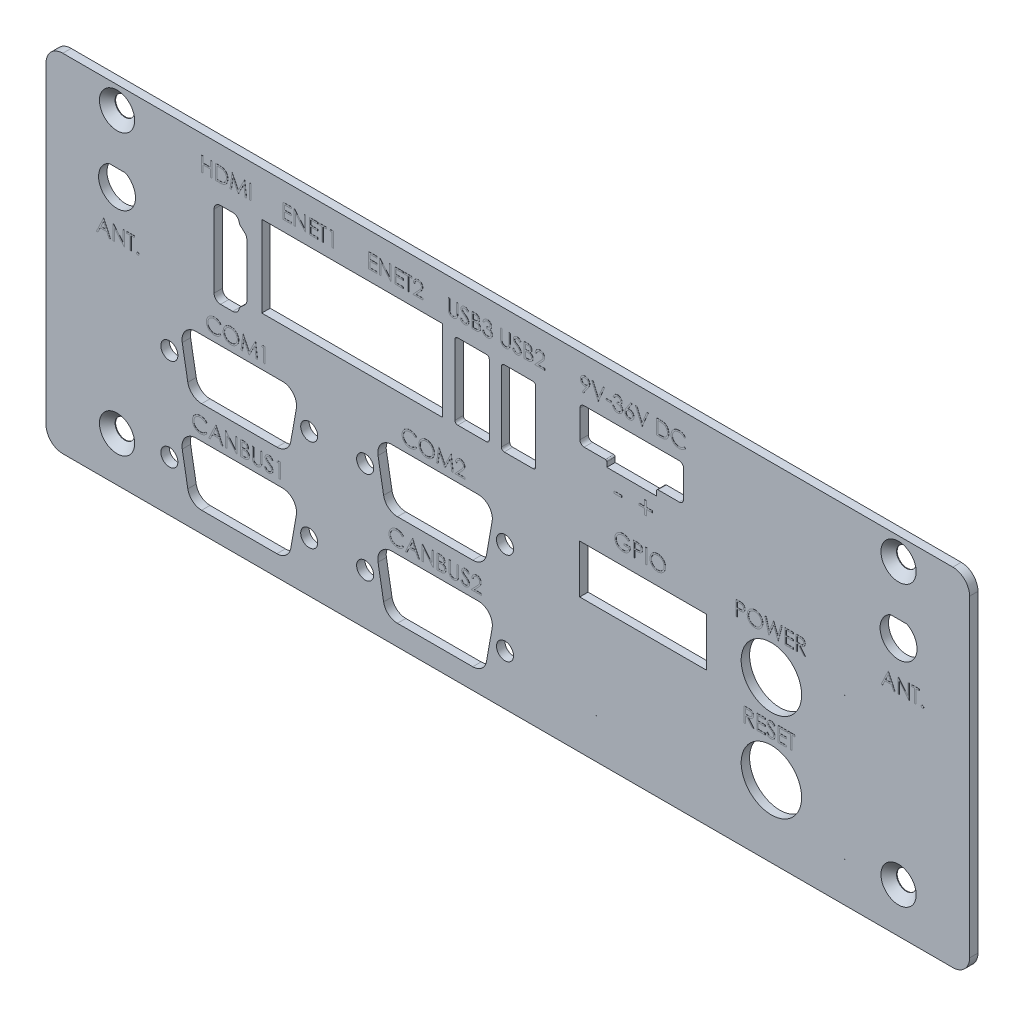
SolidWorks part; units mm, degrees
ref_plane "Front Plane" through (0, 0, 0) normal (0, 0, 1) x (1, 0, 0)
ref_plane "Top Plane" through (0, 0, 0) normal (0, 1, 0) x (1, 0, 0)
ref_plane "Right Plane" through (0, 0, 0) normal (1, 0, 0) x (0, 0, -1)
sketch "Sketch1" plane through (0, 0, 0) normal (1, 0, 0) x (0, 0, -1)
  line L0 (0, 34.1) -> (0, -34.1) construction
  line L1 (0, 0) -> (0, 62)
  line L3 (0.839, 0) -> (-0.839, 0) construction
  point P6 (0, 0)
  dimension "D2" = 62
extrude "Extrude-Thin1" add sketch "Sketch1" against normal blind 165.1 thin
sketch "Sketch4" plane through (0, 0, 1.5) normal (0, 0, 1) x (1, 0, 0)
  line L1 (-152.4, 58) -> (-12.7, 58) construction
  line L2 (-152.4, 58) -> (-152.4, 8) construction
  line L3 (-152.4, 8) -> (-12.7, 8) construction
  line L4 (-12.7, 58) -> (-12.7, 8) construction
  line L6 (-82.55, 8) -> (-82.55, 0) construction
  line L7 (0.839, 0) -> (-0.839, 0) construction
  line L8 (-165.1, 0) -> (0, 0) construction
  circle A0 centre (-152.4, 58) radius 1.75
  circle A1 centre (-152.4, 8) radius 1.75
  circle A2 centre (-12.7, 58) radius 1.75
  circle A3 centre (-12.7, 8) radius 1.75
  circle A6 centre (-152.4, 58) radius 1.75 construction
  point P19 (-82.55, 0)
  dimension "D1" = 3.5
  dimension "D5" = 8
extrude "Cut-Extrude3" cut sketch "Sketch4" against normal through all
sketch "Sketch10" plane through (0, 0, 1.5) normal (0, 0, 1) x (1, 0, 0)
  line L2 (-83.7033, 53.2428) -> (-77.5673, 53.2428) construction
  line L8 (-77.5673, 39.7268) -> (-77.5673, 53.2428) construction
  line L11 (-69.6623, 53.2748) -> (-69.6623, 48.3748) construction
  line L13 (-68.9083, 47.6208) -> (-65.1083, 47.6208) construction
  line L14 (-64.8623, 47.3748) -> (-64.8623, 46.5208) construction
  line L15 (-64.8623, 46.5208) -> (-55.9443, 46.5208) construction
  line L16 (-55.9443, 46.5208) -> (-55.9443, 47.3748) construction
  line L17 (-83.7033, 39.7268) -> (-77.5673, 39.7268) construction
  line L20 (-83.7033, 53.2428) -> (-83.7033, 39.7268) construction
  line L23 (-55.6983, 47.6208) -> (-51.8983, 47.6208) construction
  line L24 (-51.1443, 48.3748) -> (-51.1443, 53.2748) construction
  line L25 (-51.8983, 54.0288) -> (-68.9083, 54.0288) construction
  line L26 (-69.6623, 53.2748) -> (-69.6623, 48.3748)
  line L27 (-68.9083, 47.6208) -> (-65.1083, 47.6208)
  line L28 (-64.8623, 47.3748) -> (-64.8623, 46.5208)
  line L29 (-64.8623, 46.5208) -> (-55.9443, 46.5208)
  line L30 (-55.9443, 46.5208) -> (-55.9443, 47.3748)
  line L31 (-55.6983, 47.6208) -> (-51.8983, 47.6208)
  line L32 (-51.1443, 48.3748) -> (-51.1443, 53.2748)
  line L33 (-51.8983, 54.0288) -> (-68.9083, 54.0288)
  line L34 (-131.7185, 52.5388) -> (-133.9021, 52.5388) construction
  line L35 (-135.0561, 51.3848) -> (-135.0561, 38.3848) construction
  line L36 (-133.9021, 37.2308) -> (-131.7185, 37.2308) construction
  line L37 (-130.6181, 38.0373) -> (-130.509, 38.3826) construction
  line L38 (-130.4129, 38.5335) -> (-129.5723, 39.304) construction
  line L39 (-129.1981, 40.1547) -> (-129.1981, 49.6148) construction
  line L40 (-129.5723, 50.4655) -> (-130.4129, 51.236) construction
  line L41 (-130.509, 51.3869) -> (-130.6181, 51.7323) construction
  line L42 (-131.7185, 52.5388) -> (-133.9021, 52.5388)
  line L43 (-135.0561, 51.3848) -> (-135.0561, 38.3848)
  line L44 (-133.9021, 37.2308) -> (-131.7185, 37.2308)
  line L45 (-130.6181, 38.0373) -> (-130.509, 38.3826)
  line L46 (-130.4129, 38.5335) -> (-129.5723, 39.304)
  line L47 (-129.1981, 40.1547) -> (-129.1981, 49.6148)
  line L48 (-129.5723, 50.4655) -> (-130.4129, 51.236)
  line L49 (-130.509, 51.3869) -> (-130.6181, 51.7323)
  line L50 (-85.8618, 53.2428) -> (-91.9978, 53.2428) construction
  line L51 (-91.9978, 53.2428) -> (-91.9978, 39.7268) construction
  line L52 (-91.9978, 39.7268) -> (-85.8618, 39.7268) construction
  line L53 (-85.8618, 39.7268) -> (-85.8618, 53.2428) construction
  line L54 (-126.5236, 54.0828) -> (-94.2676, 54.0828) construction
  line L55 (-94.2676, 54.0828) -> (-94.2676, 39.5668) construction
  line L56 (-94.2676, 39.5668) -> (-126.5236, 39.5668) construction
  line L57 (-126.5236, 39.5668) -> (-126.5236, 54.0828) construction
  line L58 (-83.7033, 53.2428) -> (-77.5673, 53.2428)
  line L59 (-77.5673, 39.7268) -> (-77.5673, 53.2428)
  line L60 (-83.7033, 39.7268) -> (-77.5673, 39.7268)
  line L61 (-83.7033, 53.2428) -> (-83.7033, 39.7268)
  line L62 (-85.8618, 53.2428) -> (-91.9978, 53.2428)
  line L63 (-91.9978, 53.2428) -> (-91.9978, 39.7268)
  line L64 (-91.9978, 39.7268) -> (-85.8618, 39.7268)
  line L65 (-85.8618, 39.7268) -> (-85.8618, 53.2428)
  line L66 (-126.5236, 54.0828) -> (-94.2676, 54.0828)
  line L67 (-94.2676, 54.0828) -> (-94.2676, 39.5668)
  line L68 (-94.2676, 39.5668) -> (-126.5236, 39.5668)
  line L69 (-126.5236, 39.5668) -> (-126.5236, 54.0828)
  arc A0 (-133.9021, 52.5388) -> (-135.0561, 51.3848) centre (-133.9021, 51.3848) ccw construction
  arc A1 (-135.0561, 38.3848) -> (-133.9021, 37.2308) centre (-133.9021, 38.3848) ccw construction
  arc A2 (-131.7185, 37.2308) -> (-130.6181, 38.0373) centre (-131.7185, 38.3848) ccw construction
  arc A3 (-130.4129, 38.5335) -> (-130.509, 38.3826) centre (-130.1791, 38.2784) ccw construction
  arc A4 (-129.5723, 39.304) -> (-129.1981, 40.1547) centre (-130.3521, 40.1547) ccw construction
  arc A5 (-129.1981, 49.6148) -> (-129.5723, 50.4655) centre (-130.3521, 49.6148) ccw construction
  arc A6 (-130.509, 51.3869) -> (-130.4129, 51.236) centre (-130.1791, 51.4911) ccw construction
  arc A7 (-130.6181, 51.7323) -> (-131.7185, 52.5388) centre (-131.7185, 51.3848) ccw construction
  arc A16 (-68.9083, 54.0288) -> (-69.6623, 53.2748) centre (-68.9083, 53.2748) ccw construction
  arc A17 (-69.6623, 48.3748) -> (-68.9083, 47.6208) centre (-68.9083, 48.3748) ccw construction
  arc A18 (-64.8623, 47.3748) -> (-65.1083, 47.6208) centre (-65.1083, 47.3748) ccw construction
  arc A19 (-55.6983, 47.6208) -> (-55.9443, 47.3748) centre (-55.6983, 47.3748) ccw construction
  arc A20 (-51.8983, 47.6208) -> (-51.1443, 48.3748) centre (-51.8983, 48.3748) ccw construction
  arc A21 (-51.1443, 53.2748) -> (-51.8983, 54.0288) centre (-51.8983, 53.2748) ccw construction
  arc A28 (-68.9083, 54.0288) -> (-69.6623, 53.2748) centre (-68.9083, 53.2748) ccw
  arc A29 (-69.6623, 48.3748) -> (-68.9083, 47.6208) centre (-68.9083, 48.3748) ccw
  arc A30 (-64.8623, 47.3748) -> (-65.1083, 47.6208) centre (-65.1083, 47.3748) ccw
  arc A31 (-55.6983, 47.6208) -> (-55.9443, 47.3748) centre (-55.6983, 47.3748) ccw
  arc A32 (-51.8983, 47.6208) -> (-51.1443, 48.3748) centre (-51.8983, 48.3748) ccw
  arc A33 (-51.1443, 53.2748) -> (-51.8983, 54.0288) centre (-51.8983, 53.2748) ccw
  arc A34 (-133.9021, 52.5388) -> (-135.0561, 51.3848) centre (-133.9021, 51.3848) ccw
  arc A35 (-135.0561, 38.3848) -> (-133.9021, 37.2308) centre (-133.9021, 38.3848) ccw
  arc A36 (-131.7185, 37.2308) -> (-130.6181, 38.0373) centre (-131.7185, 38.3848) ccw
  arc A37 (-130.4129, 38.5335) -> (-130.509, 38.3826) centre (-130.1791, 38.2784) ccw
  arc A38 (-129.5723, 39.304) -> (-129.1981, 40.1547) centre (-130.3521, 40.1547) ccw
  arc A39 (-129.1981, 49.6148) -> (-129.5723, 50.4655) centre (-130.3521, 49.6148) ccw
  arc A40 (-130.509, 51.3869) -> (-130.4129, 51.236) centre (-130.1791, 51.4911) ccw
  arc A41 (-130.6181, 51.7323) -> (-131.7185, 52.5388) centre (-131.7185, 51.3848) ccw
extrude "444 IO CUTOUTS" cut sketch "Sketch10" against normal up to surface (1.5 mm away)
sketch "Sketch3" plane through (0, 0, 1.5) normal (0, 0, 1) x (1, 0, 0)
  circle A2 centre (-12.7, 46.125) radius 3.3
  circle A3 centre (-12.7, 46.125) radius 3.3
  circle A8 centre (-152.4, 46.125) radius 3.3
  circle A9 centre (-152.4, 46.125) radius 3.3
  dimension "D2" = 0
  dimension "D1" = 0
extrude "SMA BULKHEAD CUTOUTS" cut sketch "Sketch3" against normal through all
sketch "Sketch11" plane through (0, 0, 1.5) normal (0, 0, 1) x (1, 0, 0)
  line L0 (-105.7469, 27.8881) -> (-104.7506, 22.2381) construction
  line L1 (-88.8212, 20.164) -> (-102.2788, 20.164) construction
  line L2 (-85.3531, 27.8881) -> (-86.3494, 22.2381) construction
  line L3 (-87.825, 30.834) -> (-103.275, 30.834) construction
  line L4 (-140.7469, 27.8881) -> (-139.7506, 22.2381) construction
  line L5 (-137.2788, 20.164) -> (-123.8212, 20.164) construction
  line L6 (-120.3531, 27.8881) -> (-121.3494, 22.2381) construction
  line L7 (-138.275, 30.834) -> (-122.825, 30.834) construction
  line L8 (-105.7469, 27.8881) -> (-104.7506, 22.2381)
  line L9 (-88.8212, 20.164) -> (-102.2788, 20.164)
  line L10 (-85.3531, 27.8881) -> (-86.3494, 22.2381)
  line L11 (-87.825, 30.834) -> (-103.275, 30.834)
  line L12 (-140.7469, 27.8881) -> (-139.7506, 22.2381)
  line L13 (-137.2788, 20.164) -> (-123.8212, 20.164)
  line L14 (-120.3531, 27.8881) -> (-121.3494, 22.2381)
  line L15 (-138.275, 30.834) -> (-122.825, 30.834)
  circle A0 centre (-83.05, 25.5) radius 1.524 construction
  arc A1 (-103.275, 30.834) -> (-105.7469, 27.8881) centre (-103.275, 28.324) ccw construction
  arc A2 (-104.7506, 22.2381) -> (-102.2788, 20.164) centre (-102.2788, 22.674) ccw construction
  arc A3 (-88.8212, 20.164) -> (-86.3494, 22.2381) centre (-88.8212, 22.674) ccw construction
  arc A4 (-85.3531, 27.8881) -> (-87.825, 30.834) centre (-87.825, 28.324) ccw construction
  circle A5 centre (-108.05, 25.5) radius 1.524 construction
  circle A6 centre (-118.05, 25.5) radius 1.524 construction
  arc A7 (-139.7506, 22.2381) -> (-137.2788, 20.164) centre (-137.2788, 22.674) ccw construction
  arc A8 (-123.8212, 20.164) -> (-121.3494, 22.2381) centre (-123.8212, 22.674) ccw construction
  arc A9 (-120.3531, 27.8881) -> (-122.825, 30.834) centre (-122.825, 28.324) ccw construction
  arc A10 (-138.275, 30.834) -> (-140.7469, 27.8881) centre (-138.275, 28.324) ccw construction
  circle A11 centre (-143.05, 25.5) radius 1.524 construction
  circle A12 centre (-83.05, 25.5) radius 1.524
  arc A13 (-103.275, 30.834) -> (-105.7469, 27.8881) centre (-103.275, 28.324) ccw
  arc A14 (-104.7506, 22.2381) -> (-102.2788, 20.164) centre (-102.2788, 22.674) ccw
  arc A15 (-88.8212, 20.164) -> (-86.3494, 22.2381) centre (-88.8212, 22.674) ccw
  arc A16 (-85.3531, 27.8881) -> (-87.825, 30.834) centre (-87.825, 28.324) ccw
  circle A17 centre (-108.05, 25.5) radius 1.524
  circle A18 centre (-118.05, 25.5) radius 1.524
  arc A19 (-139.7506, 22.2381) -> (-137.2788, 20.164) centre (-137.2788, 22.674) ccw
  arc A20 (-123.8212, 20.164) -> (-121.3494, 22.2381) centre (-123.8212, 22.674) ccw
  arc A21 (-120.3531, 27.8881) -> (-122.825, 30.834) centre (-122.825, 28.324) ccw
  arc A22 (-138.275, 30.834) -> (-140.7469, 27.8881) centre (-138.275, 28.324) ccw
  circle A23 centre (-143.05, 25.5) radius 1.524
extrude "COM CUTOUTS" cut sketch "Sketch11" against normal up to surface (1.5 mm away)
sketch "Sketch12" plane through (0, 0, 1.5) normal (0, 0, 1) x (1, 0, 0)
  line L0 (-105.7469, 11.3881) -> (-104.7506, 5.7381) construction
  line L1 (-88.8212, 3.664) -> (-102.2788, 3.664) construction
  line L2 (-85.3531, 11.3881) -> (-86.3494, 5.7381) construction
  line L3 (-87.825, 14.334) -> (-103.275, 14.334) construction
  line L4 (-140.7469, 11.3881) -> (-139.7506, 5.7381) construction
  line L5 (-137.2788, 3.664) -> (-123.8212, 3.664) construction
  line L6 (-120.3531, 11.3881) -> (-121.3494, 5.7381) construction
  line L7 (-138.275, 14.334) -> (-122.825, 14.334) construction
  line L8 (-105.7469, 11.3881) -> (-104.7506, 5.7381)
  line L9 (-88.8212, 3.664) -> (-102.2788, 3.664)
  line L10 (-85.3531, 11.3881) -> (-86.3494, 5.7381)
  line L11 (-87.825, 14.334) -> (-103.275, 14.334)
  line L12 (-140.7469, 11.3881) -> (-139.7506, 5.7381)
  line L13 (-137.2788, 3.664) -> (-123.8212, 3.664)
  line L14 (-120.3531, 11.3881) -> (-121.3494, 5.7381)
  line L15 (-138.275, 14.334) -> (-122.825, 14.334)
  circle A0 centre (-83.05, 9) radius 1.524 construction
  arc A1 (-103.275, 14.334) -> (-105.7469, 11.3881) centre (-103.275, 11.824) ccw construction
  arc A2 (-104.7506, 5.7381) -> (-102.2788, 3.664) centre (-102.2788, 6.174) ccw construction
  arc A3 (-88.8212, 3.664) -> (-86.3494, 5.7381) centre (-88.8212, 6.174) ccw construction
  arc A4 (-85.3531, 11.3881) -> (-87.825, 14.334) centre (-87.825, 11.824) ccw construction
  circle A5 centre (-108.05, 9) radius 1.524 construction
  circle A6 centre (-118.05, 9) radius 1.524 construction
  arc A7 (-138.275, 14.334) -> (-140.7469, 11.3881) centre (-138.275, 11.824) ccw construction
  arc A8 (-139.7506, 5.7381) -> (-137.2788, 3.664) centre (-137.2788, 6.174) ccw construction
  arc A9 (-123.8212, 3.664) -> (-121.3494, 5.7381) centre (-123.8212, 6.174) ccw construction
  arc A10 (-120.3531, 11.3881) -> (-122.825, 14.334) centre (-122.825, 11.824) ccw construction
  circle A11 centre (-143.05, 9) radius 1.524 construction
  circle A12 centre (-83.05, 9) radius 1.524
  arc A13 (-103.275, 14.334) -> (-105.7469, 11.3881) centre (-103.275, 11.824) ccw
  arc A14 (-104.7506, 5.7381) -> (-102.2788, 3.664) centre (-102.2788, 6.174) ccw
  arc A15 (-88.8212, 3.664) -> (-86.3494, 5.7381) centre (-88.8212, 6.174) ccw
  arc A16 (-85.3531, 11.3881) -> (-87.825, 14.334) centre (-87.825, 11.824) ccw
  circle A17 centre (-108.05, 9) radius 1.524
  circle A18 centre (-118.05, 9) radius 1.524
  arc A19 (-138.275, 14.334) -> (-140.7469, 11.3881) centre (-138.275, 11.824) ccw
  arc A20 (-139.7506, 5.7381) -> (-137.2788, 3.664) centre (-137.2788, 6.174) ccw
  arc A21 (-123.8212, 3.664) -> (-121.3494, 5.7381) centre (-123.8212, 6.174) ccw
  arc A22 (-120.3531, 11.3881) -> (-122.825, 14.334) centre (-122.825, 11.824) ccw
  circle A23 centre (-143.05, 9) radius 1.524
extrude "CANBUS CUTOUTS" cut sketch "Sketch12" against normal up to surface (1.5 mm away)
sketch "Sketch13" plane through (0, 0, 1.5) normal (0, 0, 1) x (1, 0, 0)
  line L0 (-47.0312, 24.028) -> (-47.0312, 32.69) construction
  line L1 (-69.6932, 32.69) -> (-47.0312, 32.69) construction
  line L2 (-69.6932, 24.028) -> (-69.6932, 32.69) construction
  line L3 (-69.6932, 24.028) -> (-47.0312, 24.028) construction
  line L4 (-47.0312, 24.028) -> (-47.0312, 32.69) construction
  line L5 (-69.6932, 32.69) -> (-47.0312, 32.69) construction
  line L6 (-69.6932, 24.028) -> (-69.6932, 32.69) construction
  line L7 (-69.6932, 24.028) -> (-47.0312, 24.028) construction
  circle A0 centre (-35.4314, 28.69) radius 5.4
  circle A1 centre (-35.4314, 12.815) radius 5.4
  circle A2 centre (-66.775, 7.1) radius 0.05
  circle A3 centre (-22.325, 32.5) radius 0.05
  circle A4 centre (-22.325, 7.1) radius 0.05
  dimension "D1" = 10.8
  dimension "D2" = 0.1
extrude "0471 CUTOUTS" cut sketch "Sketch13" against normal up to surface (1.5 mm away)
sketch "Sketch14" plane through (0, 0, 1.5) normal (0, 0, 1) x (1, 0, 0)
  line L0 (-47.0312, 24.028) -> (-47.0312, 32.69) construction
  line L1 (-69.6932, 24.028) -> (-47.0312, 24.028) construction
  line L2 (-69.6932, 24.028) -> (-69.6932, 32.69) construction
  line L3 (-69.6932, 32.69) -> (-47.0312, 32.69) construction
  line L4 (-47.0312, 24.028) -> (-47.0312, 32.69)
  line L5 (-69.6932, 24.028) -> (-47.0312, 24.028)
  line L6 (-69.6932, 24.028) -> (-69.6932, 32.69)
  line L7 (-69.6932, 32.69) -> (-47.0312, 32.69)
extrude "0471 GPIO CUTOUT" cut sketch "Sketch14" against normal up to surface (1.5 mm away)
chamfer "Chamfer1" distance 1.4 angle 45 4 edges at (-10.95, 8, 1.5) (-10.95, 58, 1.5) (-150.65, 8, 1.5) (-150.65, 58, 1.5)
sketch "Sketch5" plane through (0, 0, 1.5) normal (0, 0, 1) x (1, 0, 0)
  line L0 (-165.1, 62) -> (0, 62) construction
  line L1 (-165.1, 0) -> (-165.1, 62) construction
  text T0 "HDMI     ENET1     ENET2    USB3 USB2      9V-36V DC" font "Century Gothic" height in points 10
  dimension "D1" = 6
  dimension "D2" = 27.5
extrude "444 PCB PAD PRINT" add sketch "Sketch5" along normal blind 0.0254
sketch "Sketch6" plane through (0, 0, 1.5) normal (0, 0, 1) x (1, 0, 0)
  line L0 (-165.1, 62) -> (0, 62) construction
  line L1 (-165.1, 0) -> (-165.1, 62) construction
  text T0 "COM1                       COM2" font "Century Gothic" height in points 10
  dimension "D1" = 30
  dimension "D2" = 28.5
extrude "COM PAD PRINT" add sketch "Sketch6" along normal blind 0.0254
sketch "Sketch17" plane through (0, 0, 1.5) normal (0, 0, 1) x (1, 0, 0)
  line L0 (-165.1, 62) -> (0, 62) construction
  line L1 (-165.1, 0) -> (-165.1, 62) construction
  text T0 "CANBUS1                  CANBUS2" font "Century Gothic" height in points 10
  dimension "D1" = 46.5
  dimension "D2" = 26
extrude "CANBUS PAD PRINT" add sketch "Sketch17" along normal up to surface (0.0254 mm away)
sketch "Sketch7" plane through (0, 0, 1.5) normal (0, 0, 1) x (1, 0, 0)
  line L0 (-165.1, 62) -> (0, 62) construction
  text T0 "ANT.                                                                                                                                  ANT." font "Century Gothic" height in points 10
  dimension "D1" = 24.5
extrude "ANT PAD PRINT" add sketch "Sketch7" along normal blind 0.0254
sketch "Sketch8" plane through (0, 0, 1.5) normal (0, 0, 1) x (1, 0, 0)
  line L0 (-165.1, 62) -> (0, 62) construction
  line L2 (-64.8623, 47.3748) -> (-64.8623, 46.5208) construction
  text T0 "-  +"
  dimension "D1" = 20
  dimension "D2" = 1.2
extrude "-  + PAD PRINT" add sketch "Sketch8" along normal blind 0.0254
sketch "Sketch15" plane through (0, 0, 1.5) normal (0, 0, 1) x (1, 0, 0)
  line L0 (-165.1, 62) -> (0, 62) construction
  line L1 (-165.1, 0) -> (-165.1, 62) construction
  text T0 "POWER" font "Century Gothic" height in points 10
  dimension "D1" = 27
  dimension "D2" = 123
extrude "POWER PAD PRINT" add sketch "Sketch15" along normal up to surface (0.0254 mm away)
sketch "Sketch16" plane through (0, 0, 1.5) normal (0, 0, 1) x (1, 0, 0)
  line L0 (-165.1, 62) -> (0, 62) construction
  line L1 (-165.1, 0) -> (-165.1, 62) construction
  text T0 "RESET" font "Century Gothic" height in points 10
  dimension "D1" = 42.75
  dimension "D2" = 124.5
extrude "RESET PAD PRINT" add sketch "Sketch16" along normal up to surface (0.0254 mm away)
sketch "Sketch19" plane through (0, 0, 1.5) normal (0, 0, 1) x (1, 0, 0)
  line L0 (-165.1, 62) -> (0, 62) construction
  line L1 (-165.1, 0) -> (-165.1, 62) construction
  text T0 "GPIO" font "Century Gothic" height in points 10
  dimension "D1" = 27
  dimension "D2" = 101.5
extrude "GPIO PAD PRINT" add sketch "Sketch19" along normal up to surface (0.0254 mm away)
sketch "Sketch20" plane through (0, 0, 1.5) normal (0, 0, 1) x (1, 0, 0)
  line L0 (-165.1, 62) -> (0, 62) construction
  line L1 (0, 0) -> (0, 62) construction
  text T0 "SYS-444" font "Century Gothic" height in points 10
  dimension "D1" = 58
  dimension "D2" = 62
extrude "PRODUCT NAME" [suppressed] add sketch "Sketch20" along normal up to surface (0.0254 mm away)
fillet "Fillet4" radius 3 4 edges at (0, 0, 0.75) (0, 62, 0.75) (-165.1, 0, 0.75) (-165.1, 62, 0.75)
fillet "Fillet3" radius 0.5 8 edges at (-83.7033, 53.2428, 0.75) (-77.5673, 53.2428, 0.75) (-77.5673, 39.7268, 0.75) (-83.7033, 39.7268, 0.75) (-91.9978, 39.7268, 0.75) (-85.8618, 39.7268, 0.75) (-85.8618, 53.2428, 0.75) (-91.9978, 53.2428, 0.75)
sketch "Sketch21" plane through (0, 0, 1.5) normal (0, 0, 1) x (1, 0, 0)
  line L0 (-152.4, 49.075) -> (-152.4, 42.825) construction
  line L1 (-153.879, 49.425) -> (-150.921, 49.425)
  line L2 (-153.879, 49.425) -> (-153.879, 49.075)
  line L3 (-153.879, 49.075) -> (-150.921, 49.075)
  line L4 (-150.921, 49.425) -> (-150.921, 49.075)
  line L6 (-14.179, 49.075) -> (-11.221, 49.075)
  line L7 (-14.179, 49.075) -> (-14.179, 49.425)
  line L8 (-14.179, 49.425) -> (-11.221, 49.425)
  line L9 (-11.221, 49.075) -> (-11.221, 49.425)
  circle A0 centre (-152.4, 46.125) radius 3.3 construction
  circle A1 centre (-12.7, 46.125) radius 3.3 construction
  dimension "D1" = 6.25
extrude "Boss-Extrude1" add sketch "Sketch21" against normal up to surface (1.5 mm away)
